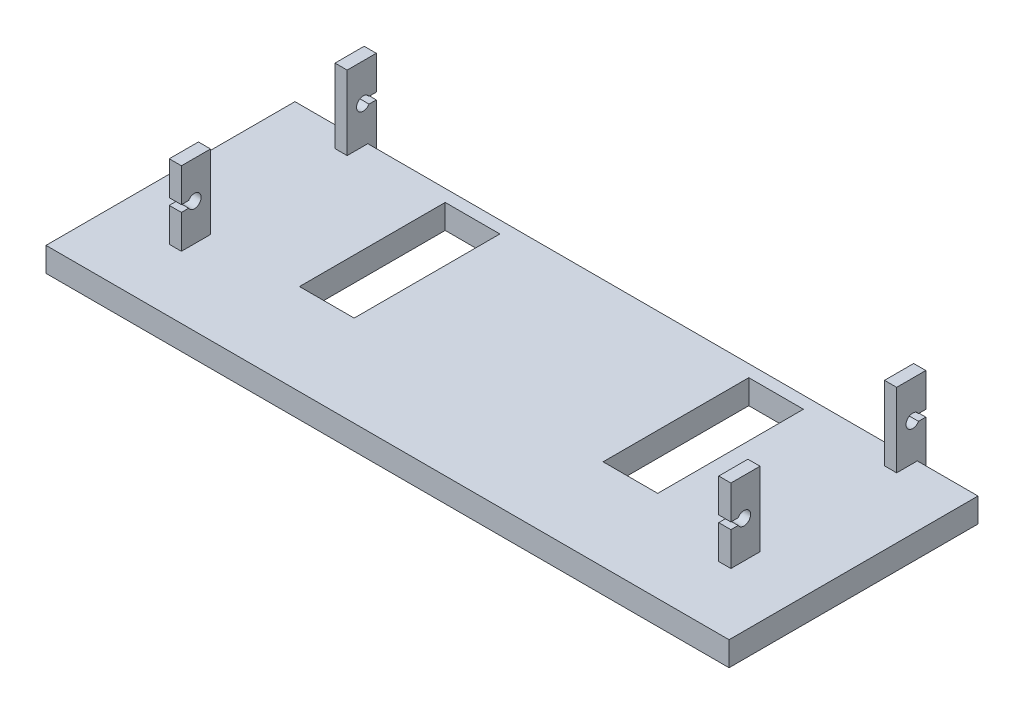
SolidWorks part; units mm, degrees
ref_plane "Front Plane" through (0, 0, 0) normal (0, 0, 1) x (1, 0, 0)
ref_plane "Top Plane" through (0, 0, 0) normal (0, 1, 0) x (1, 0, 0)
ref_plane "Right Plane" through (0, 0, 0) normal (1, 0, 0) x (0, 0, -1)
sketch "Sketch1" plane through (0, 0, 0) normal (0, 1, 0) x (1, 0, 0)
  line L1 (0, 0) -> (112.5, 0)
  line L2 (0, 0) -> (0, -41)
  line L3 (0, -41) -> (112.5, -41)
  line L4 (112.5, 0) -> (112.5, -41)
  dimension "D1" = 112.5
  dimension "D2" = 41
extrude "Boss-Extrude1" add sketch "Sketch1" along normal blind 4
sketch "Sketch2" plane through (0, 0, 0) normal (0, 1, 0) x (1, 0, 0)
  line L0 (31.25, -15) -> (31.25, -26) construction
  line L1 (26.75, -15) -> (35.75, -15)
  line L2 (26.75, -15) -> (26.75, -26)
  line L3 (26.75, -26) -> (35.75, -26)
  line L4 (35.75, -15) -> (35.75, -26)
  line L5 (76.75, -15) -> (85.75, -15)
  line L6 (76.75, -15) -> (76.75, -26)
  line L7 (76.75, -26) -> (85.75, -26)
  line L8 (85.75, -15) -> (85.75, -26)
  line L9 (81.25, -15) -> (81.25, -26) construction
  line L11 (0, -41) -> (112.5, -41) construction
  line L14 (31.25, -20.5) -> (81.25, -20.5) construction
  line L15 (56.25, 0) -> (56.25, -41) construction
  line L16 (112.5, 0) -> (0, 0) construction
  point P12 (31.25, -20.5)
  point P13 (81.25, -20.5)
  point P14 (56.25, -20.5)
  point P15 (56.25, -20.5)
  dimension "D1" = 50
  dimension "D3" = 9
  dimension "D4" = 11
extrude "Cut-Extrude2" cut sketch "Sketch2" along normal through all
ref_plane "Plane1" through (0, 4, 0) normal (0, 1, 0) x (1, 0, 0)
ref_plane "Plane2" through (0, 0, 41) normal (0, 0, 1) x (1, 0, 0)
ref_plane "Plane4" through (0, 0, 20.5) normal (0, 0, -1) x (-1, 0, 0)
ref_plane "Plane5" through (76.75, 0, 0) normal (1, 0, 0) x (0, 0, -1)
sketch "Sketch9" plane through (76.75, 0, 0) normal (1, 0, 0) x (0, 0, -1)
  line L0 (-41, 3.201) -> (-41, -3.201) construction
  line L1 (-26.737, 2.6667) -> (-20.3351, 2.6667) construction
  line L2 (-37, 1.2958) -> (-36.6306, 0)
  line L3 (-37, -49984.557) -> (-37, -49990.9589) construction
  line L4 (-37, 1.2958) -> (-32.1916, 2.6667)
  line L5 (-41, 0) -> (0, 0) construction
  line L6 (-32.1916, 2.6667) -> (-31.4313, 0)
  line L7 (22.55, 4) -> (-22.55, 4) construction
  line L9 (-36.6306, 0) -> (-31.4313, 0)
  line L10 (-41, 2.2) -> (-41, -2.2) construction
  dimension "D1" = 4
  dimension "D2" = 1.3333
  dimension "D3" = 74.087
  dimension "D4" = 5
extrude "Cut-Extrude4" cut sketch "Sketch9" along normal up to surface (9 mm away)
sketch "Sketch14" plane through (26.75, 0, 0) normal (1, 0, 0) x (0, 0, -1)
  line L0 (-41, 3.201) -> (-41, -3.201) construction
  line L1 (-26.737, 2.6667) -> (-20.3351, 2.6667) construction
  line L2 (-37, 1.2958) -> (-36.6306, 0)
  line L3 (-37, -49984.557) -> (-37, -49990.9589) construction
  line L4 (-37, 1.2958) -> (-32.1916, 2.6667)
  line L5 (-15, 0) -> (-26, 0) construction
  line L6 (-32.1916, 2.6667) -> (-31.4313, 0)
  line L9 (-36.6306, 0) -> (-31.4313, 0)
extrude "Cut-Extrude7" cut sketch "Sketch14" along normal up to surface (9 mm away)
ref_plane "Plane7" through (0, 0, 0) normal (0, 0, -1) x (-1, 0, 0)
ref_plane "Plane6" through (0, 0, 0) normal (-1, 0, 0) x (0, 0, 1)
sketch "Sketch17" plane through (0, 0, 0) normal (0, 0, -1) x (-1, 0, 0)
  line L0 (23.87, 4) -> (-23.87, 4) construction
  line L1 (-12, 4) -> (-10, 4)
  line L2 (-12, 4) -> (-12, 0)
  line L3 (-12, 0) -> (-10, 0)
  line L4 (-10, 4) -> (-10, 0)
  line L5 (-112.5, 0) -> (0, 0) construction
  line L6 (0, -2.2) -> (0, 2.2) construction
  dimension "D1" = 2
  dimension "D2" = 10
extrude "Boss-Extrude2" add sketch "Sketch17" along normal blind 1.4
sketch "Sketch15" plane through (0, 4, 0) normal (0, 1, 0) x (1, 0, 0)
  line L0 (35.75, -15) -> (26.75, -15) construction
  line L1 (26.75, -15) -> (35.75, -15) construction
  point P0 (31.25, -9.5)
  point P3 (0, 0)
  point P8 (31.25, -15)
  dimension "D1" = 5.5
sketch "Sketch16" plane through (0, 4, 0) normal (0, 1, 0) x (1, 0, 0)
  line L1 (10, 1.4) -> (12, 1.4)
  line L2 (10, 1.4) -> (10, -3.4)
  line L3 (10, -3.4) -> (12, -3.4)
  line L4 (12, 1.4) -> (12, -3.4)
  line L6 (10, 1.4) -> (10, 0) construction
  dimension "D1" = 2
  dimension "D2" = 4.8
  dimension "D3" = 6.1
extrude "Boss-Extrude3" add sketch "Sketch16" along normal blind 12.2
sketch "Sketch18" plane through (0, 0, 0) normal (-1, 0, 0) x (0, 0, 1)
  line L0 (-1.4, 16.2) -> (3.4, 16.2) construction
  line L1 (-1.4, 0) -> (-1.4, 16.2) construction
  line L3 (-1.4, 10.65) -> (0.75, 10.65)
  line L4 (-1.4, 10.65) -> (-1.4, 9.55)
  line L5 (-1.4, 9.55) -> (0.75, 9.55)
  line L6 (0.75, 10.65) -> (0.75, 9.55)
  circle A0 centre (0.75, 10.1) radius 1.1
  point P10 (0.75, 10.1)
  dimension "D1" = 2.2
  dimension "D2" = 6.1
  dimension "D3" = 2.15
  dimension "D4" = 1.1
extrude "Cut-Extrude8" cut sketch "Sketch18" against normal up to surface (100.5 mm away) contours L5 A0 L3 L6 | L3 A0 L5 L6 | A0 L3 L4 L5
sketch "Sketch19" plane through (0, 4, 0) normal (0, 1, 0) x (1, 0, 0)
  line L0 (10, 1.4) -> (10, -3.4) construction
  line L1 (10, -25.9) -> (12, -25.9)
  line L2 (10, -25.9) -> (10, -30.7)
  line L3 (10, -30.7) -> (12, -30.7)
  line L4 (12, -25.9) -> (12, -30.7)
  line L5 (10, -3.4) -> (12, -3.4) construction
  dimension "D1" = 2
  dimension "D2" = 4.8
  dimension "D3" = 22.5
extrude "Boss-Extrude4" add sketch "Sketch19" along normal blind 12.2
ref_plane "Plane8" through (0, 0, 14.65) normal (0, 0, 1) x (1, 0, 0)
mirror "Mirror1" about plane through (0, 0, 14.65) normal (0, 0, 1) of "Cut-Extrude8"
ref_plane "Plane9" through (56.25, 0, 0) normal (1, 0, 0) x (0, 0, -1)
mirror "Mirror2" about plane through (56.25, 0, 0) normal (1, 0, 0) of "Mirror1", "Boss-Extrude4", "Cut-Extrude8", "Boss-Extrude3", "Boss-Extrude2"
sketch "Sketch20" plane through (0, 4, 0) normal (0, 1, 0) x (1, 0, 0)
  line L0 (76.75, -2.2) -> (76.75, 2.2) construction
  line L1 (26.75, -15) -> (35.75, -15)
  line L2 (26.75, -15) -> (26.75, -2)
  line L3 (26.75, -2) -> (35.75, -2)
  line L4 (35.75, -15) -> (35.75, -2)
  line L5 (85.75, -15) -> (76.75, -15)
  line L6 (85.75, -15) -> (85.75, -2)
  line L7 (85.75, -2) -> (76.75, -2)
  line L8 (76.75, -15) -> (76.75, -2)
  point P12 (0, 0)
  dimension "D1" = 13
extrude "Cut-Extrude9" cut sketch "Sketch20" against normal through all
